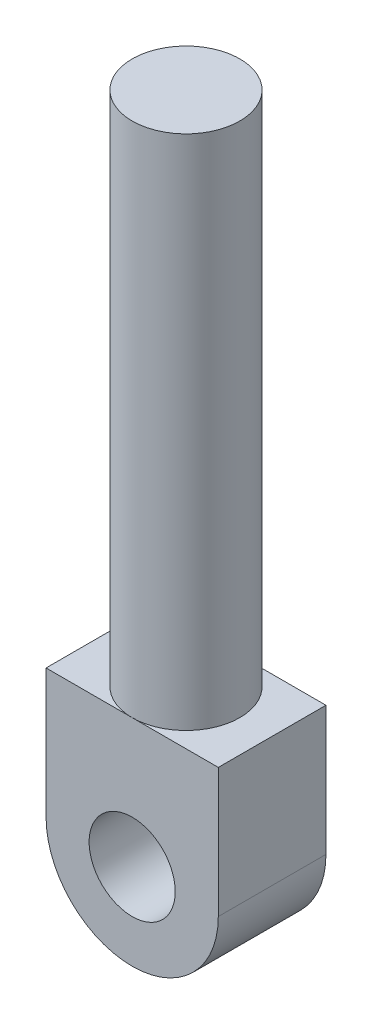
SolidWorks part; units mm, degrees
ref_plane "Front Plane" through (0, 0, 0) normal (0, 0, 1) x (1, 0, 0)
ref_plane "Top Plane" through (0, 0, 0) normal (0, 1, 0) x (1, 0, 0)
ref_plane "Right Plane" through (0, 0, 0) normal (1, 0, 0) x (0, 0, -1)
sketch "Sketch1" plane through (0, 0, 0) normal (0, 1, 0) x (1, 0, 0)
  circle A0 centre (0, 0) radius 6.25
  dimension "D1" = 12.5
extrude "Boss-Extrude1" add sketch "Sketch1" along normal blind 60
sketch "Sketch2" plane through (0, 0, 0) normal (0, 0, 1) x (1, 0, 0)
  line L0 (0, 0) -> (-10, 0)
  line L1 (-10, 0) -> (-10, -25)
  line L2 (-10, -25) -> (10, -25)
  line L3 (10, -25) -> (10, 0)
  line L4 (10, 0) -> (0, 0)
  circle A0 centre (0, -15) radius 5
  dimension "D2" = 10
  dimension "D1" = 25
  dimension "D3" = 10
  dimension "D4" = 10
  dimension "D5" = 20
  dimension "D6" = 10
extrude "Boss-Extrude2" add sketch "Sketch2" along normal mid plane 12.5
fillet "Fillet1" radius 10 2 edges at (-10, -25, 0) (10, -25, 0)
